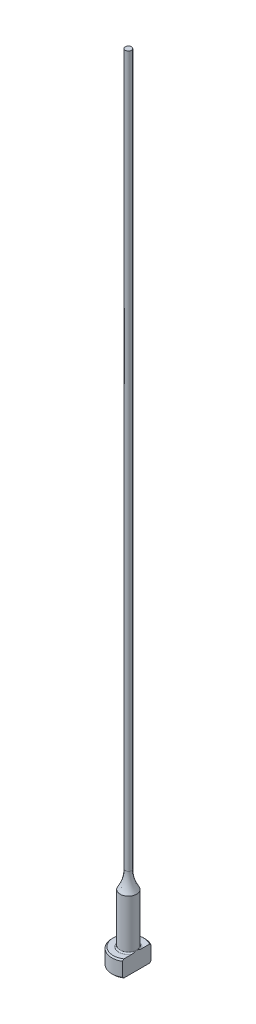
SolidWorks part; units mm, degrees
ref_plane "Front Plane" through (0, 0, 0) normal (0, 0, 1) x (1, 0, 0)
ref_plane "Top Plane" through (0, 0, 0) normal (0, 1, 0) x (1, 0, 0)
ref_plane "Right Plane" through (0, 0, 0) normal (1, 0, 0) x (0, 0, -1)
sketch "Sketch1" plane through (0, 0, 0) normal (0, 0, 1) x (1, 0, 0)
  line L0 (0, 259.9588) -> (0, -15.1925) construction
  line L1 (0, 0) -> (-3.175, 0)
  line L2 (-3.175, 0) -> (-3.175, 3.175)
  line L3 (-3.175, 3.175) -> (-1.5875, 3.175)
  line L4 (-0.5944, 16.1098) -> (-0.5944, 152.4)
  line L5 (-0.5944, 152.4) -> (0, 152.4)
  line L6 (0, 152.4) -> (0, 0)
  line L7 (-1.5875, 3.175) -> (-1.5875, 12.7)
  arc A0 (-1.5875, 12.7) -> (-0.5944, 16.1098) centre (-6.9444, 16.1098) ccw
  point P13 (-1.5875, 0)
  dimension "D1" = 6.35
  dimension "L" = 152.4
  dimension "D2" = 3.175
  dimension "H" = 6.35
  dimension "T" = 3.175
  dimension "D" = 1.1887
  dimension "S" = 12.7
revolve "Revolve1" add sketch "Sketch1" angle 360 about L0
chamfer "Chamfer1" distance 0.254 angle 45 2 edges at (0, 3.175, 3.175) (0, 0, 3.175)
fillet "Fillet1" radius 0.254 1 edges at (0, 3.175, 1.5875)
sketch "Sketch2" plane through (0, 0, 0) normal (0, 1, 0) x (1, 0, 0)
  line L0 (1.5875, -2.7496) -> (1.5875, 2.7496)
  circle A0 centre (0, 0) radius 3.175 construction
  arc A2 (1.5875, -2.7496) -> (1.5875, 2.7496) centre (0, 0) ccw
  circle A3 centre (0, 0) radius 3.175 construction
  circle A4 centre (0, 0) radius 1.5875 construction
extrude "Key Head" cut sketch "Sketch2" along normal up to next
